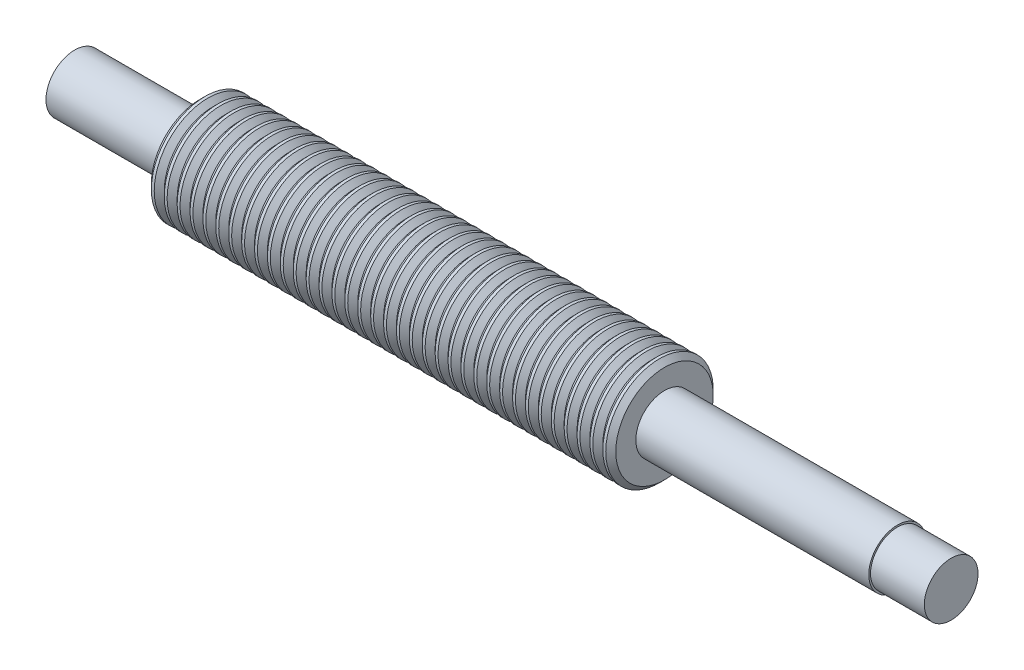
SolidWorks part; units mm, degrees
ref_plane "Ebene vorne" through (0, 0, 0) normal (0, 0, 1) x (1, 0, 0)
ref_plane "Ebene oben" through (0, 0, 0) normal (0, 1, 0) x (1, 0, 0)
ref_plane "Ebene rechts" through (0, 0, 0) normal (1, 0, 0) x (0, 0, -1)
sketch "Skizze1" plane through (0, 0, 0) normal (0, 0, 1) x (1, 0, 0)
  line L0 (0, 0) -> (0, 40)
  line L1 (0, 40) -> (175, 40)
  line L2 (175, 40) -> (175, 68)
  line L3 (175, 68) -> (182, 75)
  line L4 (823, 68) -> (823, 40)
  line L5 (823, 40) -> (1148, 40)
  line L6 (1223, 37.5) -> (1223, 0)
  line L7 (1223, 0) -> (0, 0)
  line L8 (182, 75) -> (186, 75)
  line L9 (186, 75) -> (193, 68)
  line L10 (193, 68) -> (200, 75)
  line L11 (200, 75) -> (204, 75)
  line L12 (204, 75) -> (211, 68)
  line L13 (211, 68) -> (218, 75)
  line L14 (218, 75) -> (222, 75)
  line L15 (222, 75) -> (229, 68)
  line L16 (229, 68) -> (236, 75)
  line L17 (236, 75) -> (240, 75)
  line L18 (240, 75) -> (247, 68)
  line L19 (247, 68) -> (254, 75)
  line L20 (254, 75) -> (258, 75)
  line L21 (258, 75) -> (265, 68)
  line L22 (265, 68) -> (272, 75)
  line L23 (272, 75) -> (276, 75)
  line L24 (276, 75) -> (283, 68)
  line L25 (283, 68) -> (290, 75)
  line L26 (290, 75) -> (294, 75)
  line L27 (294, 75) -> (301, 68)
  line L28 (301, 68) -> (308, 75)
  line L29 (308, 75) -> (312, 75)
  line L30 (312, 75) -> (319, 68)
  line L31 (319, 68) -> (326, 75)
  line L32 (326, 75) -> (330, 75)
  line L33 (330, 75) -> (337, 68)
  line L34 (337, 68) -> (344, 75)
  line L35 (344, 75) -> (348, 75)
  line L36 (348, 75) -> (355, 68)
  line L37 (355, 68) -> (362, 75)
  line L38 (362, 75) -> (366, 75)
  line L39 (366, 75) -> (373, 68)
  line L40 (373, 68) -> (380, 75)
  line L41 (380, 75) -> (384, 75)
  line L42 (384, 75) -> (391, 68)
  line L43 (391, 68) -> (398, 75)
  line L44 (398, 75) -> (402, 75)
  line L45 (402, 75) -> (409, 68)
  line L46 (409, 68) -> (416, 75)
  line L47 (416, 75) -> (420, 75)
  line L48 (420, 75) -> (427, 68)
  line L49 (427, 68) -> (434, 75)
  line L50 (434, 75) -> (438, 75)
  line L51 (438, 75) -> (445, 68)
  line L52 (445, 68) -> (452, 75)
  line L53 (452, 75) -> (456, 75)
  line L54 (456, 75) -> (463, 68)
  line L55 (463, 68) -> (470, 75)
  line L56 (470, 75) -> (474, 75)
  line L57 (474, 75) -> (481, 68)
  line L58 (481, 68) -> (488, 75)
  line L59 (488, 75) -> (492, 75)
  line L60 (492, 75) -> (499, 68)
  line L61 (499, 68) -> (506, 75)
  line L62 (506, 75) -> (510, 75)
  line L63 (510, 75) -> (517, 68)
  line L64 (517, 68) -> (524, 75)
  line L65 (524, 75) -> (528, 75)
  line L66 (528, 75) -> (535, 68)
  line L67 (535, 68) -> (542, 75)
  line L68 (542, 75) -> (546, 75)
  line L69 (546, 75) -> (553, 68)
  line L70 (553, 68) -> (560, 75)
  line L71 (560, 75) -> (564, 75)
  line L72 (564, 75) -> (571, 68)
  line L73 (571, 68) -> (578, 75)
  line L74 (578, 75) -> (582, 75)
  line L75 (582, 75) -> (589, 68)
  line L76 (589, 68) -> (596, 75)
  line L77 (596, 75) -> (600, 75)
  line L78 (600, 75) -> (607, 68)
  line L79 (607, 68) -> (614, 75)
  line L80 (614, 75) -> (618, 75)
  line L81 (618, 75) -> (625, 68)
  line L82 (625, 68) -> (632, 75)
  line L83 (632, 75) -> (636, 75)
  line L84 (636, 75) -> (643, 68)
  line L85 (643, 68) -> (650, 75)
  line L86 (650, 75) -> (654, 75)
  line L87 (654, 75) -> (661, 68)
  line L88 (661, 68) -> (668, 75)
  line L89 (668, 75) -> (672, 75)
  line L90 (672, 75) -> (679, 68)
  line L91 (679, 68) -> (686, 75)
  line L92 (686, 75) -> (690, 75)
  line L93 (690, 75) -> (697, 68)
  line L94 (697, 68) -> (704, 75)
  line L95 (704, 75) -> (708, 75)
  line L96 (708, 75) -> (715, 68)
  line L97 (715, 68) -> (722, 75)
  line L98 (722, 75) -> (726, 75)
  line L99 (726, 75) -> (733, 68)
  line L100 (733, 68) -> (740, 75)
  line L101 (740, 75) -> (744, 75)
  line L102 (744, 75) -> (751, 68)
  line L103 (751, 68) -> (758, 75)
  line L104 (758, 75) -> (762, 75)
  line L105 (762, 75) -> (769, 68)
  line L106 (769, 68) -> (776, 75)
  line L107 (776, 75) -> (780, 75)
  line L108 (780, 75) -> (787, 68)
  line L109 (787, 68) -> (794, 75)
  line L110 (794, 75) -> (798, 75)
  line L111 (798, 75) -> (805, 68)
  line L112 (805, 68) -> (812, 75)
  line L113 (812, 75) -> (816, 75)
  line L114 (816, 75) -> (823, 68)
  line L115 (175, 68) -> (193, 68) construction
  line L116 (0, 0) -> (1223, 0) construction
  line L117 (1148, 40) -> (1148, 37.5)
  line L118 (1148, 37.5) -> (1223, 37.5)
  dimension "D1" = 40
  dimension "D2" = 45
  dimension "D3" = 648
  dimension "D4" = 75
  dimension "D5" = 68
  dimension "D6" = 400
  dimension "D7" = 175
  dimension "D8" = 37.5
  dimension "D9" = 75
revolve "Welle" add sketch "Skizze1" angle 360 about L116
sketch "Skizze2" plane through (0, 0, 0) normal (0, 0, 1) x (1, 0, 0)
  line L0 (193, 69.0395) -> (185, 61.0395)
  line L1 (183, 61.0395) -> (175, 69.0395)
  line L2 (193, -68) -> (193, 68) construction
  line L3 (200, 75) -> (193, 68) construction
  line L4 (186, 75) -> (182, 75) construction
  line L5 (175, 68) -> (175, -68) construction
  line L6 (184, 60.0395) -> (184, 75) construction
  line L8 (183, 61.0395) -> (183, 59.0395)
  line L9 (183, 59.0395) -> (185, 59.0395)
  line L10 (185, 61.0395) -> (185, 59.0395)
  line L11 (175, 69.0395) -> (175, 78)
  line L12 (175, 78) -> (193, 78)
  line L13 (193, 69.0395) -> (193, 78)
  dimension "D1" = 90
  dimension "D2" = 0.735
  dimension "D3" = 3
  dimension "D4" = 2
  dimension "D5" = 2
extrude "Dreiecknut" cut sketch "Skizze2" against normal mid plane 100
ref_plane "Ebene Mitte Dreiecknut" through (184, 0, 0) normal (1, 0, 0) x (0, 0, -1)
sketch "Messskizze" plane through (175, 0, 0) normal (-1, 0, 0) x (0, 0, 1)
  line L0 (0, 0) -> (-42.1438, 62.0395) construction
  line L1 (-42.1438, 62.0395) -> (42.1438, 62.0395) construction
  line L2 (42.1438, 62.0395) -> (0, 0) construction
  circle A0 centre (0, 0) radius 78.1979 construction
  point P5 (0, 62.0395)
  point P7 (0, 78.1979)
  point P9 (0, 83.1979)
  dimension "D1" = 156.3958
  dimension "D2" = 5
sketch "36-0-7" plane through (175, 0, 0) normal (-1, 0, 0) x (0, 0, 1)
  line L0 (0, 0) -> (0, 75) construction
  line L1 (0, 0) -> (-57.4533, 48.2091) construction
  line L2 (0, 0) -> (-73.8606, -13.0236) construction
  line L3 (0, 0) -> (-37.5, -64.9519) construction
  line L4 (0, 0) -> (25.6515, -70.4769) construction
  line L5 (0, 0) -> (70.4769, -25.6515) construction
  line L6 (0, 0) -> (64.9519, 37.5) construction
  line L8 (0, 0) -> (13.0236, 73.8606) construction
  arc A0 (-42.1438, 62.0395) -> (42.1438, 62.0395) centre (0, 0) ccw construction
  circle A1 centre (0, 0) radius 75 construction
  dimension "D1" = 50
sketch "7-14" plane through (175, 0, 0) normal (-1, 0, 0) x (0, 0, 1)
  line L0 (0, 0) -> (13.0236, 73.8606) construction
  line L1 (0, 0) -> (13.0236, 73.8606) construction
  line L2 (0, 0) -> (-48.2091, 57.4533) construction
  line L3 (0, 0) -> (-75, 0) construction
  line L4 (0, 0) -> (-48.2091, -57.4533) construction
  line L5 (0, 0) -> (13.0236, -73.8606) construction
  line L6 (0, 0) -> (64.9519, -37.5) construction
  line L7 (0, 0) -> (70.4769, 25.6515) construction
  line L8 (0, 0) -> (25.6515, 70.4769) construction
  arc A0 (-42.1438, 62.0395) -> (42.1438, 62.0395) centre (0, 0) ccw construction
  dimension "D1" = 50
sketch "14-21" plane through (175, 0, 0) normal (-1, 0, 0) x (0, 0, 1)
  line L0 (0, 0) -> (25.6515, 70.4769) construction
  line L1 (0, 0) -> (25.6515, 70.4769) construction
  line L2 (0, 0) -> (-37.5, 64.9519) construction
  line L3 (0, 0) -> (-73.8606, 13.0236) construction
  line L4 (0, 0) -> (-57.4533, -48.2091) construction
  line L5 (0, 0) -> (0, -75) construction
  line L6 (0, 0) -> (57.4533, -48.2091) construction
  line L7 (0, 0) -> (73.8606, 13.0236) construction
  line L8 (0, 0) -> (37.5, 64.9519) construction
  arc A0 (-42.1438, 62.0395) -> (42.1438, 62.0395) centre (0, 0) ccw construction
  dimension "D1" = 50
sketch "21-28" plane through (175, 0, 0) normal (-1, 0, 0) x (0, 0, 1)
  line L0 (0, 0) -> (37.5, 64.9519) construction
  line L1 (0, 0) -> (37.5, 64.9519) construction
  line L2 (0, 0) -> (-25.6515, 70.4769) construction
  line L3 (0, 0) -> (-70.4769, 25.6515) construction
  line L4 (0, 0) -> (-64.9519, -37.5) construction
  line L5 (0, 0) -> (-13.0236, -73.8606) construction
  line L6 (0, 0) -> (48.2091, -57.4533) construction
  line L7 (0, 0) -> (75, 0) construction
  line L8 (0, 0) -> (48.2091, 57.4533) construction
  arc A0 (-42.1438, 62.0395) -> (42.1438, 62.0395) centre (0, 0) ccw construction
  dimension "D1" = 50
sketch "28-35" plane through (175, 0, 0) normal (-1, 0, 0) x (0, 0, 1)
  line L0 (0, 0) -> (48.2091, 57.4533) construction
  line L1 (0, 0) -> (48.2091, 57.4533) construction
  line L2 (0, 0) -> (-13.0236, 73.8606) construction
  line L3 (0, 0) -> (-64.9519, 37.5) construction
  line L4 (0, 0) -> (-70.4769, -25.6515) construction
  line L5 (0, 0) -> (-25.6515, -70.4769) construction
  line L6 (0, 0) -> (37.5, -64.9519) construction
  line L7 (0, 0) -> (73.8606, -13.0236) construction
  line L8 (0, 0) -> (57.4533, 48.2091) construction
  arc A0 (-42.1438, 62.0395) -> (42.1438, 62.0395) centre (0, 0) ccw construction
  dimension "D1" = 50
sketch3d "3D-Kurve 50° Versatz"
  point P0 (202, 48.2091, -57.4533)
  point P1 (220, -13.0236, -73.8606)
  point P2 (238, -64.9519, -37.5)
  point P3 (256, -70.4769, 25.6515)
  point P4 (274, -25.6515, 70.4769)
  point P5 (292, 37.5, 64.9519)
  point P6 (310, 73.8606, 13.0236)
  point P7 (760, -70.4769, -25.6515)
  point P12 (328, 57.4533, -48.2091)
  point P13 (346, 0, -75)
  point P14 (364, -57.4533, -48.2091)
  point P15 (382, -73.8606, 13.0236)
  point P16 (400, -37.5, 64.9519)
  point P24 (418, 25.6515, 70.4769)
  point P25 (436, 70.4769, 25.6515)
  point P26 (454, 64.9519, -37.5)
  point P27 (472, 13.0236, -73.8606)
  point P28 (490, -48.2091, -57.4533)
  point P29 (508, -75, 0)
  point P30 (526, -48.2091, 57.4533)
  point P33 (544, 13.0236, 73.8606)
  point P38 (562, 64.9519, 37.5)
  point P39 (580, 70.4769, -25.6515)
  point P40 (598, 25.6515, -70.4769)
  point P41 (616, -37.5, -64.9519)
  point P42 (634, -73.8606, -13.0236)
  point P43 (652, -57.4533, 48.2091)
  point P44 (670, 0, 75)
  point P45 (688, 57.4533, 48.2091)
  point P46 (706, 73.8606, -13.0236)
  point P47 (724, 37.5, -64.9519)
  point P48 (742, -25.6515, -70.4769)
  point P50 (778, -64.9519, 37.5)
  point P51 (796, -13.0236, 73.8606)
  point P52 (814, 48.2091, 57.4533)
  point P53 (184, 75, 0)
  dimension "D9" = 162
  dimension "D30" = 540
  dimension "D35" = 630
  dimension "D36" = 18
  dimension "D2" = 36
  dimension "D3" = 54
  dimension "D4" = 72
  dimension "D5" = 90
  dimension "D6" = 108
  dimension "D7" = 126
  dimension "D8" = 144
  dimension "D10" = 180
  dimension "D11" = 198
  dimension "D12" = 216
  dimension "D13" = 234
  dimension "D14" = 252
  dimension "D15" = 270
  dimension "D16" = 288
  dimension "D17" = 306
  dimension "D18" = 324
  dimension "D19" = 342
  dimension "D20" = 360
  dimension "D21" = 378
  dimension "D22" = 396
  dimension "D23" = 414
  dimension "D24" = 432
  dimension "D25" = 450
  dimension "D26" = 468
  dimension "D27" = 486
  dimension "D28" = 504
  dimension "D29" = 522
  dimension "D31" = 558
  dimension "D32" = 576
  dimension "D33" = 594
  dimension "D34" = 612
curve "Kurve1"
pattern_curve "Kurvenmuster Dreiecknut" parameters "D1"=36, "D3"=50, "D2"=1, "D4"=50
ref_plane "Passfedernut d=80" through (985.5, 40, 0) normal (0, 1, 0) x (0, 0, -1)
ref_plane "Passfedernut d=75" through (1185.5, 37.5, 0) normal (0, 1, 0) x (0, 0, -1)
sketch "Skizze8" plane through (1185.5, 37.5, 0) normal (0, 1, 0) x (0, 0, -1)
  line L0 (10, -17.5) -> (10, 18.5)
  line L2 (-10, 18.5) -> (-10, -17.5)
  line L3 (-37.5, -37.5) -> (37.5, -37.5) construction
  arc A0 (10, 18.5) -> (-10, 18.5) centre (0, 18.5) ccw
  arc A1 (-10, -17.5) -> (10, -17.5) centre (0, -17.5) ccw
  dimension "D1" = 56
  dimension "D2" = 20
  dimension "D3" = 20
extrude "Schnitt-Linear Passfedernut d=75" cut sketch "Skizze8" against normal blind 7.5
sketch "Skizze9" plane through (985.5, 40, 0) normal (0, 1, 0) x (0, 0, -1)
  line L0 (11, -95.5) -> (11, -136.5)
  line L1 (-37.5, -162.5) -> (37.5, -162.5) construction
  line L2 (-11, -136.5) -> (-11, -95.5)
  arc A0 (-11, -136.5) -> (11, -136.5) centre (0, -136.5) ccw
  arc A1 (11, -95.5) -> (-11, -95.5) centre (0, -95.5) ccw
  dimension "D2" = 63
  dimension "D3" = 15
  dimension "D1" = 22
extrude "Schnitt-Linear Passfedernut d=80" cut sketch "Skizze9" against normal blind 9
